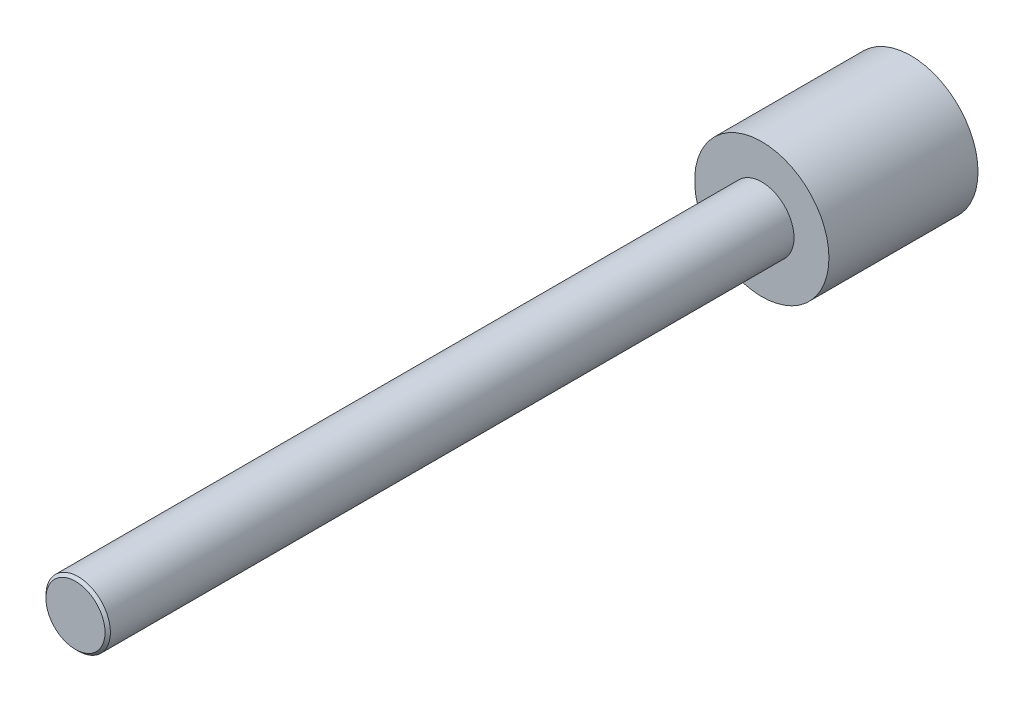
SolidWorks part; units mm, degrees
ref_plane "Front" through (0, 0, 0) normal (0, 0, 1) x (1, 0, 0)
ref_plane "Top" through (0, 0, 0) normal (0, 1, 0) x (1, 0, 0)
ref_plane "Right" through (0, 0, 0) normal (1, 0, 0) x (0, 0, -1)
ref_plane "Shaft Plane 1" through (0, 0, -0.254) normal (0, 0, 1) x (1, 0, 0)
sketch "Sketch1" plane through (0, 0, 0) normal (0, 0, 1) x (1, 0, 0)
  circle A0 centre (0, 0) radius 3.048
  dimension "活塞杆径" = 6.096
extrude "Base-Extrude" add sketch "Sketch1" along normal blind 78.74
sketch "Sketch2" plane through (0, 0, -0.254) normal (0, 0, 1) x (1, 0, 0)
  circle A0 centre (0, 0) radius 6.35
  dimension "活塞径" = 12.7
extrude "Boss-Extrude1" add sketch "Sketch2" along normal blind 14.097
chamfer "Chamfer1" distance 0.254 angle 45 1 edges at (3.048, 0, 78.74)
